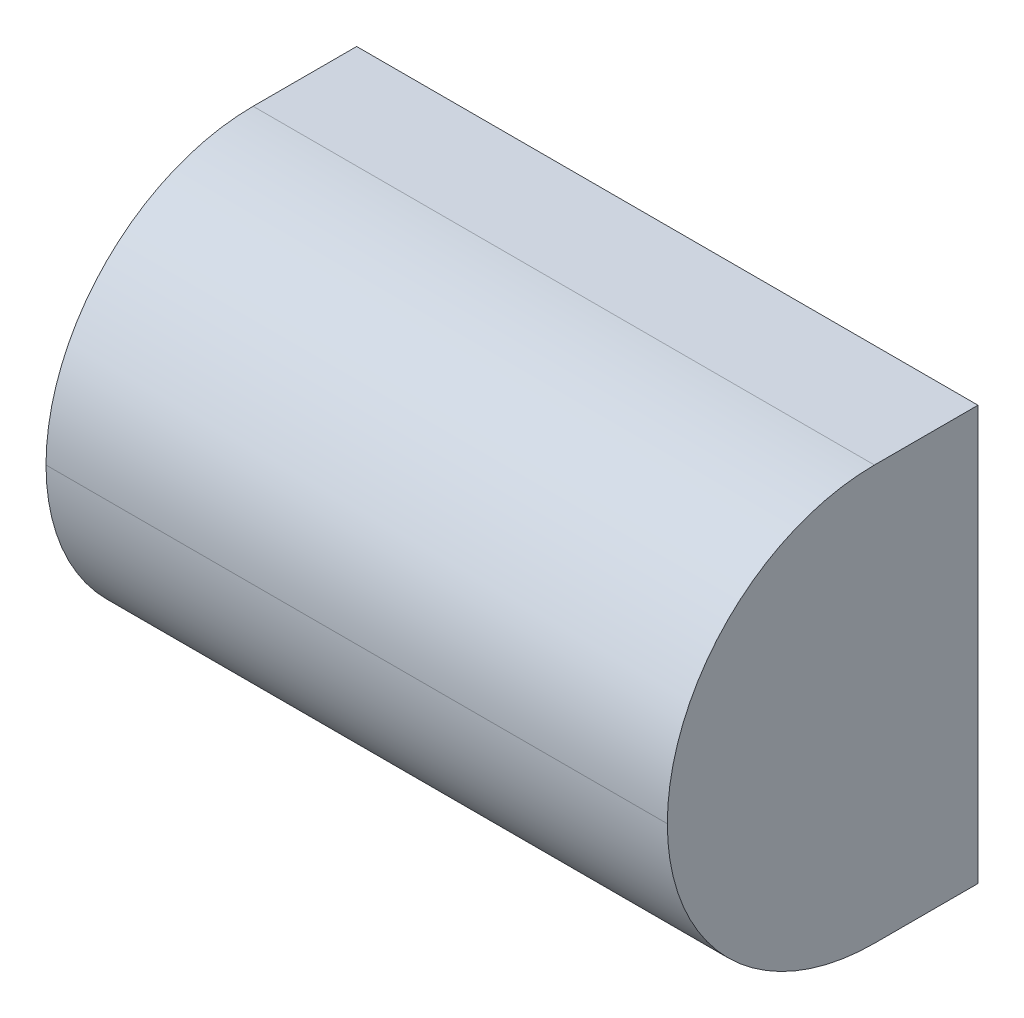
SolidWorks part; units mm, degrees
ref_plane "Face" through (0, 0, 0) normal (0, 0, 1) x (1, 0, 0)
ref_plane "Dessus" through (0, 0, 0) normal (0, 1, 0) x (1, 0, 0)
ref_plane "Droite" through (0, 0, 0) normal (1, 0, 0) x (0, 0, -1)
sketch "Esquisse1" plane through (0, 0, 0) normal (0, 0, 1) x (1, 0, 0)
  line L1 (-4.5, 3) -> (4.5, 3)
  line L2 (-4.5, 3) -> (-4.5, -3)
  line L3 (-4.5, -3) -> (4.5, -3)
  line L4 (4.5, 3) -> (4.5, -3)
  dimension "D1" = 9
  dimension "D2" = 4.5
  dimension "D3" = 3
  dimension "D4" = 6
extrude "Extrusion1" add sketch "Esquisse1" along normal blind 4.5
fillet "Congé1" radius 3 2 edges at (0, -3, 4.5) (0, 3, 4.5)
